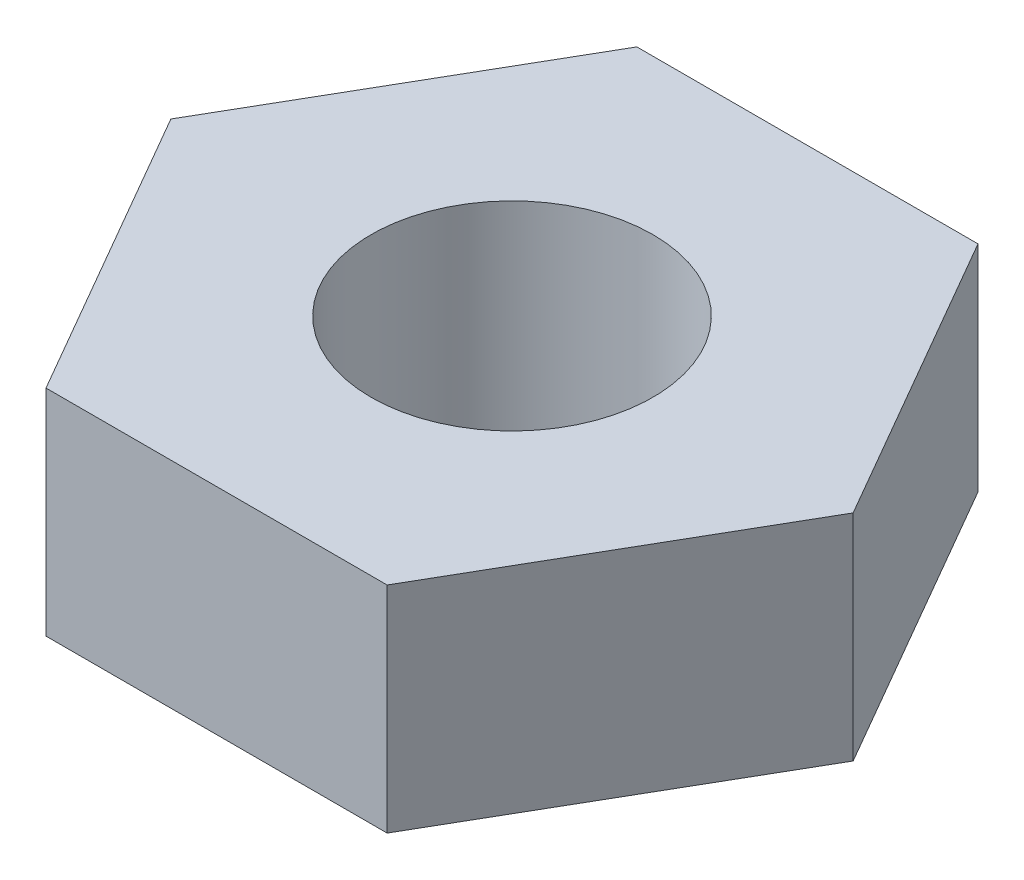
SolidWorks part; units mm, degrees
ref_plane "Front Plane" through (0, 0, 0) normal (0, 0, 1) x (1, 0, 0)
ref_plane "Top Plane" through (0, 0, 0) normal (0, 1, 0) x (1, 0, 0)
ref_plane "Right Plane" through (0, 0, 0) normal (1, 0, 0) x (0, 0, -1)
sketch "Sketch1" plane through (0, 0, 0) normal (0, 1, 0) x (1, 0, 0)
  line L1 (5.041, 0) -> (2.5205, 4.3656)
  line L2 (2.5205, 4.3656) -> (-2.5205, 4.3656)
  line L3 (-2.5205, 4.3656) -> (-5.041, 0)
  line L4 (-5.041, 0) -> (-2.5205, -4.3656)
  line L5 (-2.5205, -4.3656) -> (2.5205, -4.3656)
  line L6 (2.5205, -4.3656) -> (5.041, 0)
  circle A0 centre (0, 0) radius 2.0828
  circle A1 centre (0, 0) radius 4.3656 construction
  dimension "D1" = 4.1656
  dimension "D2" = 8.7312
extrude "Boss-Extrude1" add sketch "Sketch1" along normal mid plane 3.175
